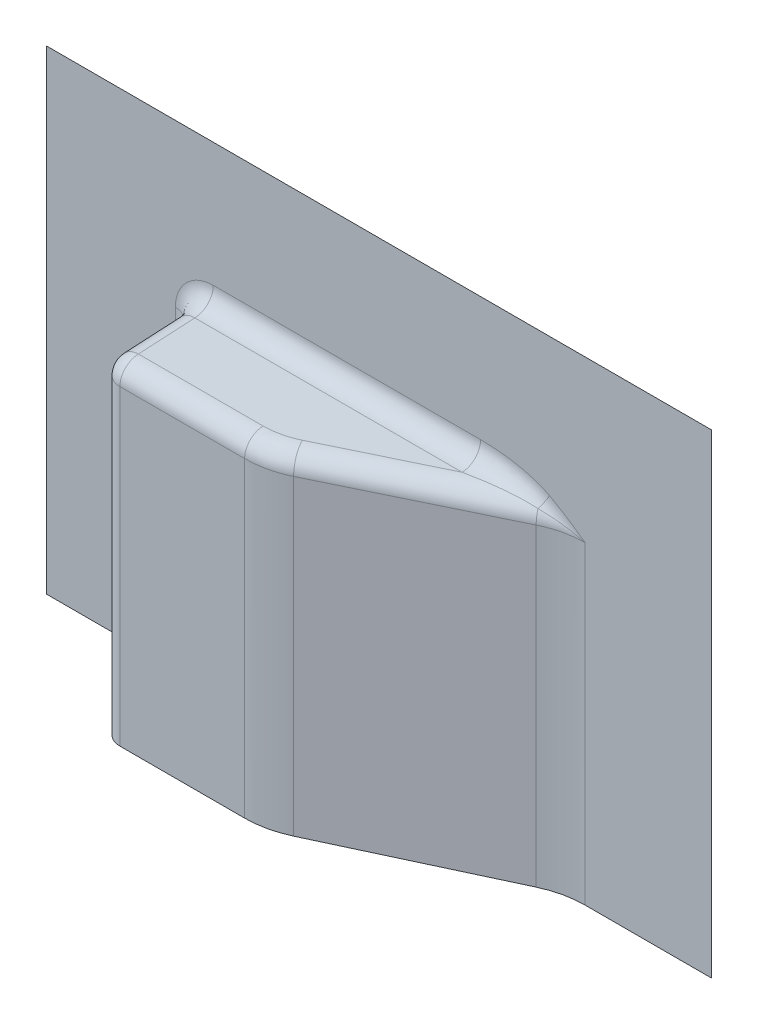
SolidWorks part; units mm, degrees
ref_plane "Front Plane" through (0, 0, 0) normal (0, 0, 1) x (1, 0, 0)
ref_plane "Top Plane" through (0, 0, 0) normal (0, 1, 0) x (1, 0, 0)
ref_plane "Right Plane" through (0, 0, 0) normal (1, 0, 0) x (0, 0, -1)
sketch "Sketch1" plane through (0, 0, 0) normal (0, 0, 1) x (1, 0, 0)
  line L1 (-175, 0) -> (175, 0)
  line L2 (-175, 0) -> (-175, 250)
  line L3 (-175, 250) -> (175, 250)
  line L4 (175, 0) -> (175, 250)
  line L5 (-175, 0) -> (175, 250) construction
  line L6 (-175, 250) -> (175, 0) construction
  point P0 (0, 125)
  dimension "D1" = 350
  dimension "D2" = 250
surface "Surface-Plane1" sketch "Sketch1"
sketch "Sketch2" plane through (0, 0, 0) normal (0, 1, 0) x (1, 0, 0)
  line L0 (97.5, 0) -> (-9.6886, -49.9829)
  line L2 (-9.6886, -49.9829) -> (-96.1912, -49.9829)
  line L3 (-96.1912, -49.9829) -> (-97.5, 0)
  line L4 (-97.5, 0) -> (97.5, 0) construction
  dimension "D1" = 25
  dimension "D2" = 50
  dimension "D3" = 195
  dimension "D4" = 88.5
surface "Surface-Extrude1" sketch "Sketch2" parameters "D1"=175
surface "Surface-Plane2"
surface "Surface-Trim1"
draft "Draft1" type of draft neutral plane draft angle 1.5 faces to draft 1 parameters "D1"=1.5
fillet "Fillet1" radius 50 2 edges at (97.5, 87.5, 0) (-9.6886, 86.8456, 49.9829)
fillet "Fillet2" radius 10 8 edges at (-97.5, 87.5, 0) (97.7628, 174.969, 1.1852) (43.9057, 174.3456, 24.9914) (-9.9514, 173.7222, 48.7977) (-58.4822, 173.6912, 49.9829) (-96.1912, 86.8456, 49.9829) (5.5424, 175, 0) (-96.8456, 174.3456, 24.9914)
